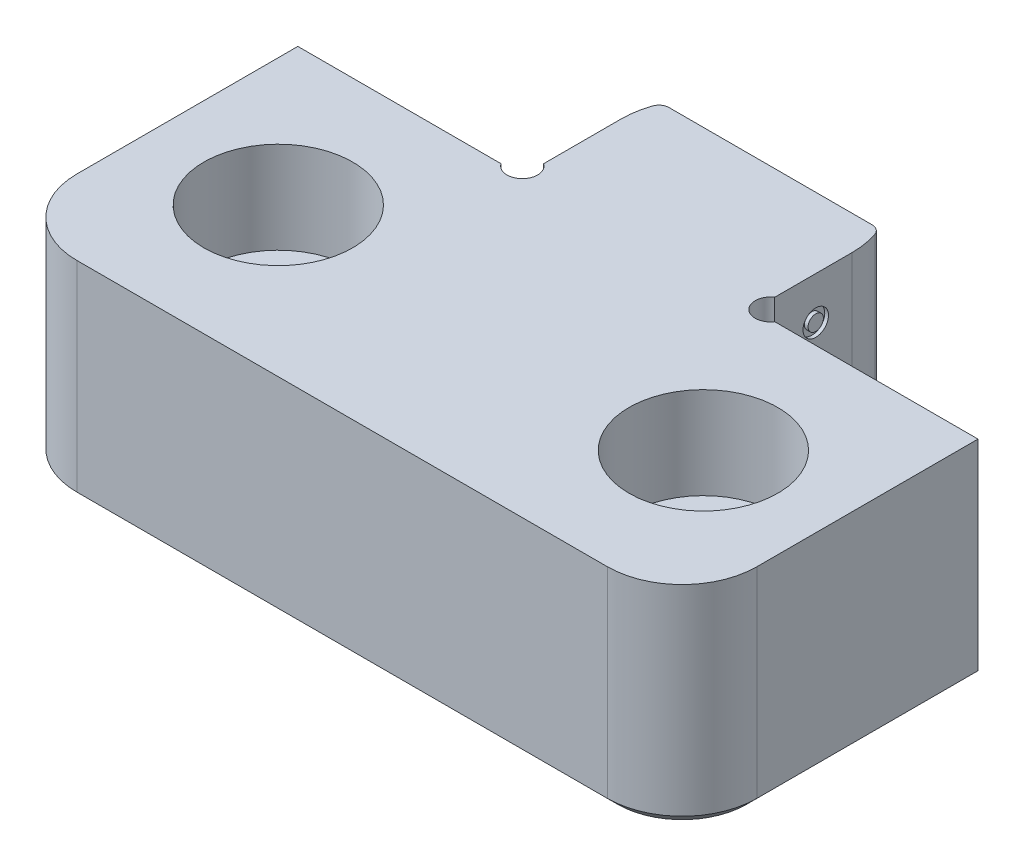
SolidWorks part; units mm, degrees
ref_plane "Front Plane" through (0, 0, 0) normal (0, 0, 1) x (1, 0, 0)
ref_plane "Top Plane" through (0, 0, 0) normal (0, 1, 0) x (1, 0, 0)
ref_plane "Right Plane" through (0, 0, 0) normal (1, 0, 0) x (0, 0, -1)
sketch "Sketch1" plane through (0, 0, 0) normal (0, 1, 0) x (1, 0, 0)
  line L0 (-25.4, -22.098) -> (25.4, -22.098)
  line L1 (8.6335, 0) -> (8.6335, 7.366)
  line L6 (-8.6335, 0) -> (-8.6335, 7.366)
  line L7 (-7.5811, 9.906) -> (7.5811, 9.906)
  line L9 (8.6335, 0) -> (25.4, 0)
  line L10 (25.4, 0) -> (25.4, -22.098)
  line L12 (0, 0) -> (0, 50000) construction
  line L13 (0, 0) -> (-50000, 0) construction
  line L21 (-25.4, 0) -> (-25.4, -22.098)
  line L22 (-8.6335, 0) -> (-25.4, 0)
  arc A0 (-8.6335, 7.366) -> (-8.3034, 9.3865) centre (-2.2835, 7.366) cw
  arc A1 (8.6335, 7.366) -> (8.3034, 9.3865) centre (2.2835, 7.366) ccw
  arc A2 (-7.5811, 9.906) -> (-8.3034, 9.3865) centre (-7.5811, 9.144) ccw
  arc A3 (7.5811, 9.906) -> (8.3034, 9.3865) centre (7.5811, 9.144) cw
  point P14 (-8.1033, 9.906)
  point P21 (8.1033, 9.906)
  dimension "D5" = 6.35
  dimension "D7" = 0.762
  dimension "D8" = 0.762
  dimension "D1" = 8.6335
  dimension "D2" = 22.098
  dimension "D3" = 9.906
  dimension "D4" = 50.8
  dimension "D6" = 2.54
extrude "Boss-Extrude1" add sketch "Sketch1" against normal blind 15.748 separate body
sketch "Sketch3" plane through (0, 0, 0) normal (0, 1, 0) x (1, 0, 0)
  line L0 (0, 0) -> (0, 50000) construction
  line L1 (0, 0) -> (50000, 0) construction
  line L2 (9.2685, 0.635) -> (9.2685, -0.508) construction
  line L3 (9.2685, 0.635) -> (8.1255, 0.635) construction
  line L4 (8.6335, 0) -> (8.6335, 7.366) construction
  circle A0 centre (9.2685, 0.635) radius 1.143
  circle A1 centre (-9.2685, 0.635) radius 1.143
  dimension "D1" = 1.143
  dimension "D2" = 0.508
  dimension "D3" = 0.508
extrude "Cut-Extrude2" cut sketch "Sketch3" against normal through all
fillet "Fillet1" radius 5.588 2 edges at (25.4, -7.874, 22.098) (-25.4, -7.874, 22.098)
chamfer "Chamfer1" distance 0.762 angle 45 5 edges at (-25.4, -15.748, 8.255) (25.4, -15.748, 8.255) (-23.7633, -15.748, 20.4613) (23.7633, -15.748, 20.4613) (0, -15.748, 22.098)
hole_wizard "1/4\" CBORE" positions "Sketch7" profile "Sketch6" counterbore size "1/4" standard "ANSI Inch"
sketch "Sketch7" plane through (0, 0, 0) normal (0, 1, 0) x (-1, 0, 0)
  line L0 (0, 0) -> (0, 50000) construction
  line L1 (0, 0) -> (50000, 0) construction
  line L2 (25.4, 0) -> (25.4, 16.51) construction
  line L3 (19.812, 22.098) -> (-19.812, 22.098) construction
  point P0 (15.875, 10.9855)
  point P16 (-15.875, 10.9855)
  dimension "D1" = 9.525
  dimension "D2" = 11.1125
sketch "Sketch6" plane through (-15.875, 0, 10.9855) normal (1, 0, 0) x (0, 0, 1)
  line L0 (0, 0) -> (0, 15.748)
  line L1 (0, 15.748) -> (3.5687, 15.748)
  line L3 (3.5687, 15.748) -> (3.5687, 6.858)
  line L4 (3.5687, 6.858) -> (5.5562, 6.858)
  line L5 (5.5562, 6.858) -> (5.5562, 0)
  line L7 (5.5562, 0) -> (0, 0)
  line L11 (0, -6.35) -> (0, 107.95) construction
  dimension "Thru Hole Dia." = 7.1374
  dimension "Thru Hole Depth" = 15.748
  dimension "C'Bore Dia." = 11.1125
  dimension "C'Bore Depth" = 6.858
sketch "Sketch8" plane through (8.6335, 0, 0) normal (1, 0, 0) x (0, 0, -1)
  line L0 (4.6482, -17.1702) -> (4.6482, 2.119) construction
  circle A0 centre (4.6482, -3.175) radius 0.5715
  circle A1 centre (4.6482, -3.175) radius 0.9525
  circle A2 centre (4.6482, -6.3246) radius 0.5715
  circle A3 centre (4.6482, -6.3246) radius 0.9525
  circle A4 centre (4.6482, -9.4996) radius 0.5715
  circle A5 centre (4.6482, -9.4996) radius 0.9525
  circle A6 centre (4.6482, -12.6746) radius 0.5715
  circle A7 centre (4.6482, -12.6746) radius 0.9525
  dimension "D2" = 1.143
  dimension "D4" = 1.905
  dimension "D5" = 12.6746
  dimension "D1" = 4.6482
  dimension "D3" = 3.175
  dimension "D6" = 9.4996
  dimension "D7" = 6.3246
extrude "Cut-Extrude3" cut sketch "Sketch8" against normal blind 0.2794
mirror "Mirror1" about plane through (0, 0, 0) normal (1, 0, 0) of "Cut-Extrude3"
sketch "Sketch9" plane through (8.6335, 0, 0) normal (1, 0, 0) x (0, 0, -1)
  line L0 (2.286, -15.748) -> (9.906, -15.748)
  line L1 (9.906, -15.748) -> (9.906, -15.2891)
  line L2 (1.5854, -15.748) -> (7.366, -15.748) construction
  arc A0 (2.286, -15.748) -> (9.906, -15.2891) centre (2.286, 47.752) ccw
  dimension "D1" = 63.5
  dimension "D2" = 7.62
extrude "Cut-Extrude4" cut sketch "Sketch9" against normal through all
